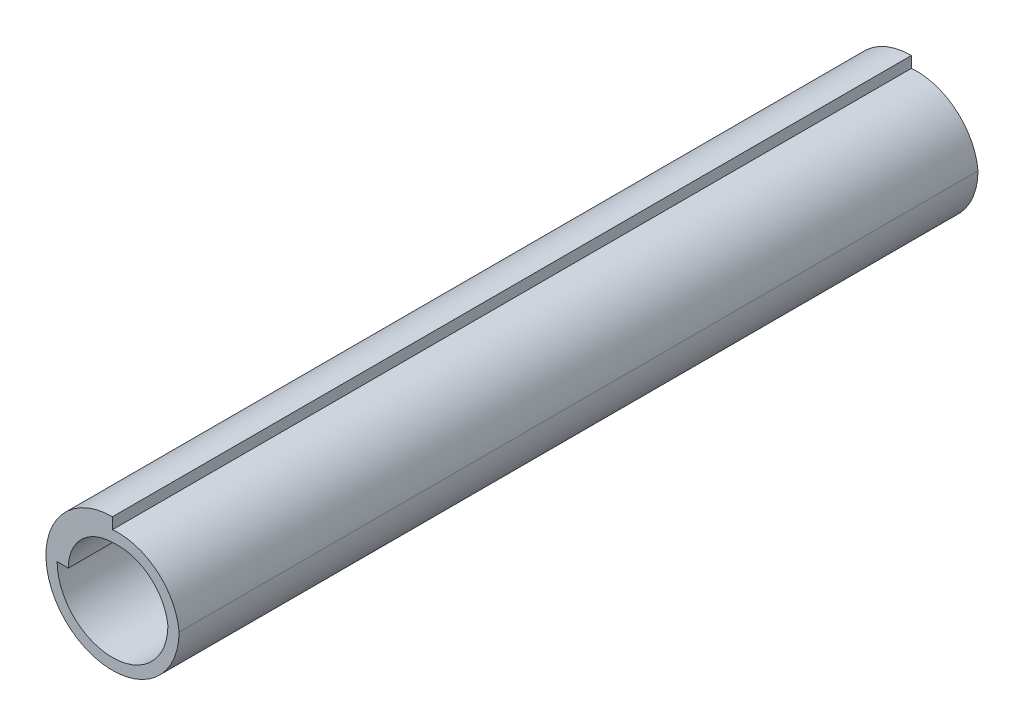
SolidWorks part; units mm, degrees
ref_plane "Plane1" through (0, 0, 0) normal (0, 0, 1) x (1, 0, 0)
ref_plane "Plane2" through (0, 0, 0) normal (0, 1, 0) x (1, 0, 0)
ref_plane "Plane3" through (0, 0, 0) normal (1, 0, 0) x (0, 0, -1)
sketch "Sketch1" plane through (0, 0, 0) normal (0, 0, 1) x (1, 0, 0)
  line L0 (0, 2.08) -> (0, 2.5)
  line L1 (-2.08, 0) -> (-1.66, 0)
  line L2 (0, 1.66) -> (2.08, 0) construction
  line L3 (0.21, -0.21) -> (1.04, 0.83) construction
  line L4 (0, 2.08) -> (2.5, 0) construction
  line L5 (0.21, -0.21) -> (1.25, 1.04) construction
  arc A0 (0, 2.5) -> (2.5, 0) centre (0, 0) ccw
  arc A1 (-2.08, 0) -> (2.08, 0) centre (0, 0) ccw
  arc A2 (0, 1.66) -> (-1.66, 0) centre (0, 0) ccw
  arc A3 (2.08, 0) -> (0, 1.66) centre (0.21, -0.21) ccw
  arc A4 (2.5, 0) -> (0, 2.08) centre (0.21, -0.21) ccw
  dimension "D1" = 0.42
  dimension "Diameter" = 5
  dimension "D2" = 4.16
  dimension "Thickness" = 0.42
extrude "Base-Extrude" add sketch "Sketch1" along normal mid plane 30
equation "\"D1@Sketch1\" = \"Thickness@Sketch1\""
equation "\"D2@Sketch1\" = \"Diameter@Sketch1\" - \"Thickness@Sketch1\" * 2"
